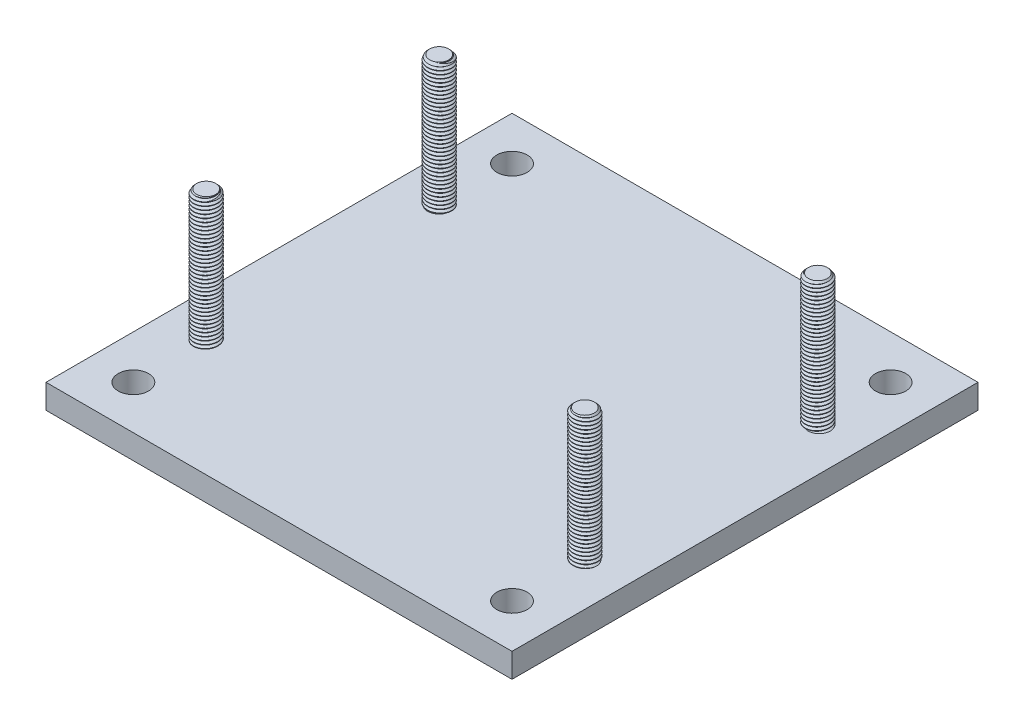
SolidWorks part; units mm, degrees
other "<95412A818_18-8 Stainless Steel Threaded Rod>-<Cut-Sweep1>"
ref_plane "Front Plane" through (0, 0, 0) normal (0, 0, 1) x (1, 0, 0)
ref_plane "Top Plane" through (0, 0, 0) normal (0, 1, 0) x (1, 0, 0)
ref_plane "Right Plane" through (0, 0, 0) normal (1, 0, 0) x (0, 0, -1)
sketch "Sketch1" plane through (0, 0, 0) normal (0, 1, 0) x (1, 0, 0)
  line L1 (-152.4, 152.4) -> (152.4, 152.4)
  line L2 (-152.4, 152.4) -> (-152.4, -152.4)
  line L3 (-152.4, -152.4) -> (152.4, -152.4)
  line L4 (152.4, 152.4) -> (152.4, -152.4)
  line L5 (-152.4, 152.4) -> (152.4, -152.4) construction
  line L6 (-152.4, -152.4) -> (152.4, 152.4) construction
  point P0 (0, 0)
  dimension "D1" = 304.8
extrude "Boss-Extrude1" add sketch "Sketch1" along normal blind 15.875
hole_wizard "5/8-11 Tapped Hole1" positions "Sketch2" profile "Sketch3" tap size "5/8-11" standard "ANSI Inch"
sketch "Sketch2" plane through (0, 15.875, 0) normal (0, 1, 0) x (1, 0, 0)
  point P0 (-123.825, -76.2)
  point P3 (123.825, -76.2)
  point P6 (-123.825, 76.2)
  point P9 (123.825, 76.2)
sketch "Sketch3" plane through (-123.825, 15.875, 76.2) normal (1, 0, 0) x (0, 0, 1)
  line L0 (0, 0) -> (0, 15.875)
  line L1 (0, 15.875) -> (6.7462, 15.875)
  line L2 (6.7462, 15.875) -> (6.7462, 0)
  line L5 (6.7462, 0) -> (0, 0)
  line L11 (0, -6.35) -> (0, 107.95) construction
  dimension "Thread Major Dia." = 13.4925
  dimension "Thru Tap Drill Depth" = 15.875
hole_wizard "3/4 Clearance Hole1" positions "Sketch4" profile "Sketch5" hole size "3/4" standard "ANSI Inch"
sketch "Sketch4" plane through (0, 15.875, 0) normal (0, 1, 0) x (1, 0, 0)
  line L0 (-152.4, 0) -> (-95.2664, 0) construction
  line L1 (-152.4, 152.4) -> (-152.4, -152.4) construction
  line L4 (-123.825, -76.2) -> (-123.825, -123.825) construction
  line L6 (-152.4, -152.4) -> (152.4, -152.4) construction
  line L7 (0, -152.4) -> (0, -96.8124) construction
  point P0 (-123.825, -123.825)
  point P2 (-123.825, 123.825)
  point P25 (123.825, -123.825)
  point P26 (123.825, 123.825)
  dimension "D1" = 28.575
sketch "Sketch5" plane through (-123.825, 15.875, 123.825) normal (1, 0, 0) x (0, 0, 1)
  line L0 (0, 0) -> (0, 15.875)
  line L1 (0, 15.875) -> (9.9212, 15.875)
  line L2 (9.9212, 15.875) -> (9.9212, 0)
  line L5 (9.9212, 0) -> (0, 0)
  line L11 (0, -6.35) -> (0, 107.95) construction
  dimension "Thru Hole Dia." = 19.8425
  dimension "Thru Hole Depth" = 15.875
inserted part "95412A818_18-8 Stainless Steel Threaded Rod"
move or copy body "Body-Move/Copy6" placed by mates yes
mirror "Mirror3" about plane through (0, 0, 0) normal (0, 0, 1)
mirror "Mirror4" about plane through (0, 0, 0) normal (1, 0, 0)
